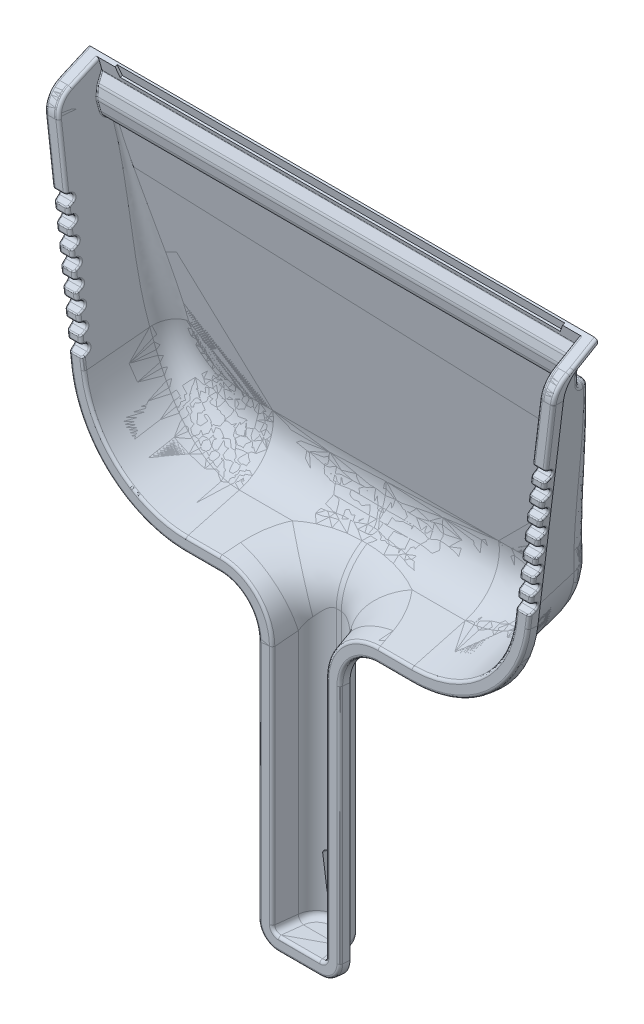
SolidWorks part; units mm, degrees
ref_plane "Front Plane" through (0, 0, 0) normal (0, 0, 1) x (1, 0, 0)
ref_plane "Top Plane" through (0, 0, 0) normal (0, 1, 0) x (1, 0, 0)
ref_plane "Right Plane" through (0, 0, 0) normal (1, 0, 0) x (0, 0, -1)
imported_body "Imported1"
scale "Scale1" scale about centroid uniform scaling yes scale factor 1.04
other "Parting Line1"
other "Shut-Off Surface1"
